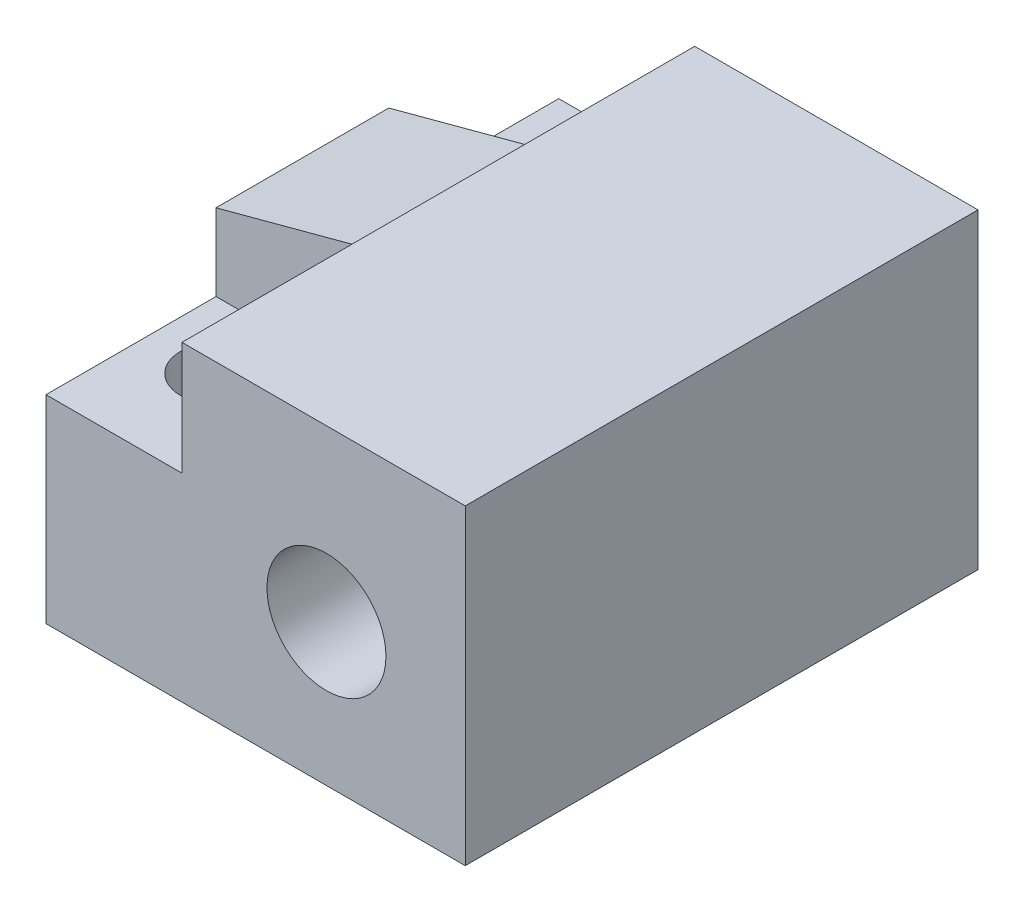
SolidWorks part; units mm, degrees
ref_plane "Plane1" through (0, 0, 0) normal (0, 0, 1) x (1, 0, 0)
ref_plane "Plane2" through (0, 0, 0) normal (0, 1, 0) x (1, 0, 0)
ref_plane "Plane3" through (0, 0, 0) normal (1, 0, 0) x (0, 0, -1)
sketch "Sketch1" plane through (0, 0, 0) normal (0, 0, 1) x (1, 0, 0)
  line L0 (0, 0) -> (14.8, 0)
  line L1 (14.8, 0) -> (14.8, 11)
  line L2 (14.8, 11) -> (4.8, 11)
  line L3 (0, 9.7138) -> (0, 0)
  line L4 (4.8, 11) -> (0, 9.7138)
  dimension "D1" = 11
  dimension "D2" = 14.8
  dimension "D3" = 10
  dimension "D4" = 15
extrude "Manifold Base" add sketch "Sketch1" against normal blind 18.1
sketch "P Port" plane through (0, 0, 0) normal (0, 0, 1) x (1, 0, 0)
  line L0 (14.8, 0) -> (14.8, 11) construction
  line L1 (0, 0) -> (14.8, 0) construction
  circle A0 centre (9.9, 5) radius 2.1
  dimension "D3" = 4.2
  dimension "D1" = 4.9
  dimension "D2" = 5
extrude "P porting" cut sketch "P Port" against normal through all
sketch "E Port" plane through (0, 0, 0) normal (-1, 0, 0) x (0, 0, 1)
  line L0 (0, 9.7138) -> (0, 0) construction
  line L1 (-18.1, 0) -> (0, 0) construction
  circle A0 centre (-9.7, 5) radius 2.1
  dimension "D3" = 4.2
  dimension "D1" = 9.7
  dimension "D2" = 5
extrude "E porting" cut sketch "E Port" against normal blind 6
ref_plane "Plane4" through (0, 7, 0) normal (0, 1, 0) x (-1, 0, 0)
sketch "Sketch5" plane through (0, 7, 0) normal (0, 1, 0) x (-1, 0, 0)
  line L2 (0, -18.1) -> (0, 0) construction
  line L3 (-4.8, -18.1) -> (-4.8, 0) construction
  line L4 (-4.8, 0) -> (0, 0) construction
  line L5 (-4.8, 0) -> (0, 0)
  line L7 (0, -9.05) -> (-9.2805, -9.05) construction
  line L8 (-4.8, -6) -> (0, -6)
  line L10 (0, -6) -> (0, 0)
  line L11 (-4.8, -6) -> (-4.8, 0)
  line L12 (-4.8, -12.1) -> (-4.8, -18.1)
  line L13 (0, -12.1) -> (0, -18.1)
  line L14 (-4.8, -12.1) -> (0, -12.1)
  line L15 (-4.8, -18.1) -> (0, -18.1)
  dimension "D1" = 6
extrude "Cut-Extrude4" cut sketch "Sketch5" along normal up to vertex
sketch "Sketch6" plane through (0, 7, 0) normal (0, 1, 0) x (-1, 0, 0)
  line L0 (-14.8, -18.1) -> (-14.8, 0) construction
  line L1 (0, 0) -> (-4.8, 0) construction
  circle A0 centre (-2.4, -3.7) radius 1.35
  circle A1 centre (-2.4, -15.7) radius 1.35
  dimension "D1" = 2.7
  dimension "D2" = 12.4
  dimension "D3" = 3.7
  dimension "D4" = 12
extrude "Mounting holes" cut sketch "Sketch6" against normal through all
